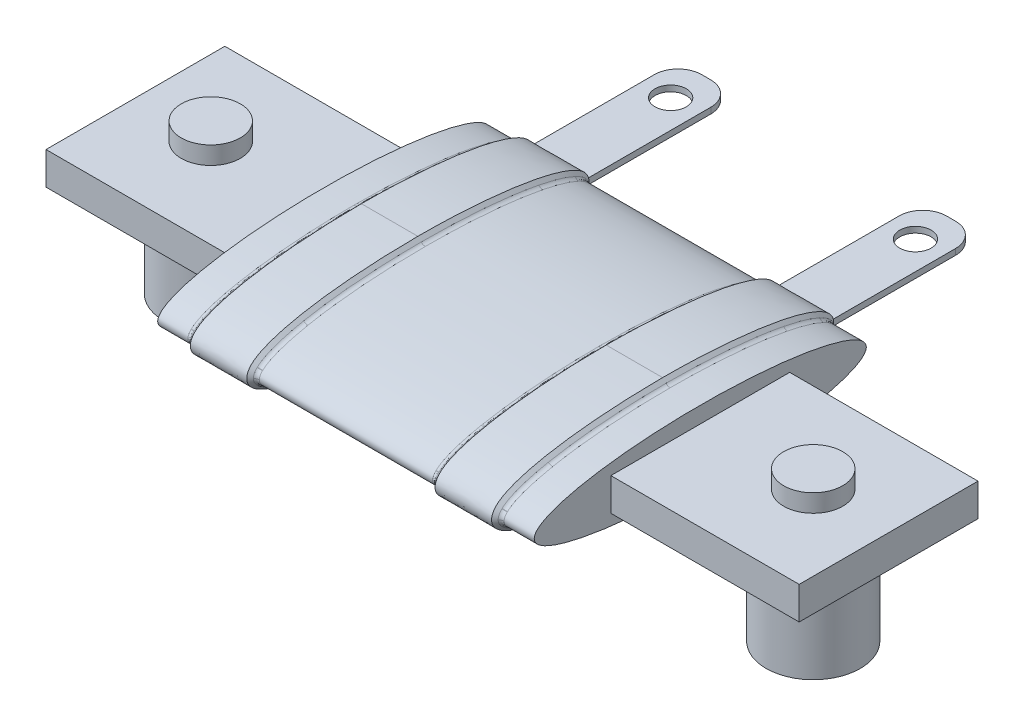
SolidWorks part; units mm, degrees
ref_plane "Front Plane" through (0, 0, 0) normal (0, 0, 1) x (1, 0, 0)
ref_plane "Top Plane" through (0, 0, 0) normal (0, 1, 0) x (1, 0, 0)
ref_plane "Right Plane" through (0, 0, 0) normal (1, 0, 0) x (0, 0, -1)
sketch "Sketch1" plane through (0, 0, 0) normal (1, 0, 0) x (0, 0, -1)
  ellipse E0 centre (0, 0) end of major axis (14, 0) minor radius 2.75
  dimension "D1" = 28
  dimension "D2" = 5.5
extrude "Core" add sketch "Sketch1" along normal mid plane 31.75
ref_plane "Terminal Plane" through (10.32, 0, 0) normal (1, 0, 0) x (0, 0, -1)
sketch "Sketch3" plane through (15.875, 0, 0) normal (1, 0, 0) x (0, 0, -1)
  line L1 (-7.54, 1.375) -> (7.54, 1.375)
  line L2 (-7.54, 1.375) -> (-7.54, -1.375)
  line L3 (-7.54, -1.375) -> (7.54, -1.375)
  line L4 (7.54, 1.375) -> (7.54, -1.375)
  line L5 (-7.54, 1.375) -> (7.54, -1.375) construction
  line L6 (-7.54, -1.375) -> (7.54, 1.375) construction
  point P0 (0, 0)
  dimension "D1" = 15.08
  dimension "D2" = 2.75
extrude "MtgBar" add sketch "Sketch3" along normal blind 15.88
sketch "Sketch4" plane through (10.32, 0, 0) normal (1, 0, 0) x (0, 0, -1)
  ellipse E0 centre (0, 0) end of major axis (14, 0) minor radius 2.75
  ellipse E1 centre (0, 0) end of major axis (14, 0) minor radius 2.75 construction
sketch "Sketch5" plane through (0, 0, 0) normal (0, 0, 1) x (1, 0, 0)
  line L0 (7.515, 2.75) -> (13.125, 2.75)
  line L1 (10.32, -2.75) -> (10.32, 2.75) construction
  line L2 (10.32, -3.025) -> (10.32, 3.025) construction
  line L3 (15.875, 2.75) -> (-15.875, 2.75) construction
  line L4 (13.125, 2.75) -> (12.7, 3.175)
  line L5 (12.7, 3.175) -> (7.94, 3.175)
  line L6 (10.32, 2.75) -> (10.32, 5.368) construction
  line L7 (7.515, 2.75) -> (7.94, 3.175)
  line L8 (0, 0) -> (7.9995, 0) construction
  point P13 (10.32, 3.175)
  dimension "D1" = 2.38
  dimension "D2" = 45
  dimension "D3" = 6.35
sweep "TermPattrn" add profiles "Sketch5" path "Sketch4"
fillet "Fillet1" radius 0.5 31 edges
sketch "Sketch6" plane through (0, 0, 0) normal (0, 0, 1) x (1, 0, 0)
  line L0 (0, 0) -> (22.1881, 0) construction
  line L1 (10.32, -3.025) -> (10.32, 3.025) construction
  line L2 (7.94, -0.25) -> (12.7, -0.25)
  line L3 (7.94, -0.25) -> (7.94, 0.25)
  line L4 (7.94, 0.25) -> (12.7, 0.25)
  line L5 (12.7, -0.25) -> (12.7, 0.25)
  line L6 (7.94, -0.25) -> (12.7, 0.25) construction
  line L7 (7.94, 0.25) -> (12.7, -0.25) construction
  point P3 (10.32, 0)
  dimension "D1" = 0.5
  dimension "D2" = 4.76
extrude "TermLngth" add sketch "Sketch6" against normal blind 26.7
sketch "Sketch7" plane through (0, 0.25, 0) normal (0, 1, 0) x (1, 0, 0)
  line L0 (10.32, -3.025) -> (10.32, 3.025) construction
  line L1 (12.7, 26.7) -> (7.94, 26.7) construction
  circle A0 centre (10.32, 23.7) radius 1.32
  dimension "D1" = 2.64
  dimension "D2" = 3
extrude "Cut-Extrude1" cut sketch "Sketch7" against normal through all
fillet "Fillet2" radius 2 2 edges at (12.7, 0, -26.7) (7.94, 0, -26.7)
mirror "Mirror1" about plane through (0, 0, 0) normal (1, 0, 0) of "Cut-Extrude1", "Fillet2", "TermLngth", "Fillet1", "TermPattrn", "MtgBar"
sketch "Sketch8" plane through (0, 1.375, 0) normal (0, 1, 0) x (1, 0, 0)
  line L0 (0, 0) -> (0, 20.7329) construction
  circle A0 centre (25.4, 0) radius 2.49
  circle A1 centre (-25.4, 0) radius 2.49
extrude "Boss-Extrude4" add sketch "Sketch8" along normal blind 1.5
sketch "Sketch9" plane through (0, -1.375, 0) normal (0, -1, 0) x (1, 0, 0)
  line L0 (0, 0) -> (0, -21.1598) construction
  circle A0 centre (25.4, 0) radius 3.97
  circle A1 centre (-25.4, 0) radius 3.97
extrude "Boss-Extrude5" add sketch "Sketch9" along normal blind 30
sketch "Sketch10" plane through (0, 0, 0) normal (0, 0, 1) x (1, 0, 0)
  line L0 (-29.37, -31.375) -> (-21.43, -31.375) construction
  line L1 (-31.755, -53.015) -> (31.755, -53.015)
  line L2 (-31.755, -53.015) -> (-31.755, -9.735)
  line L3 (-31.755, -9.735) -> (31.755, -9.735)
  line L4 (31.755, -53.015) -> (31.755, -9.735)
  line L5 (-31.755, -53.015) -> (31.755, -9.735) construction
  line L6 (-31.755, -9.735) -> (31.755, -53.015) construction
  line L7 (-31.755, 1.375) -> (-31.755, -1.375) construction
  line L8 (-31.755, 1.375) -> (-15.875, 1.375) construction
  line L9 (31.755, 1.375) -> (31.755, -1.375) construction
  point P0 (0, -31.375)
  dimension "D1" = 11.11
extrude "Cut-Extrude2" cut sketch "Sketch10" against normal through all both and the other way through all
equation "\"D2@Sketch9\"=\"D2@Sketch8\""
